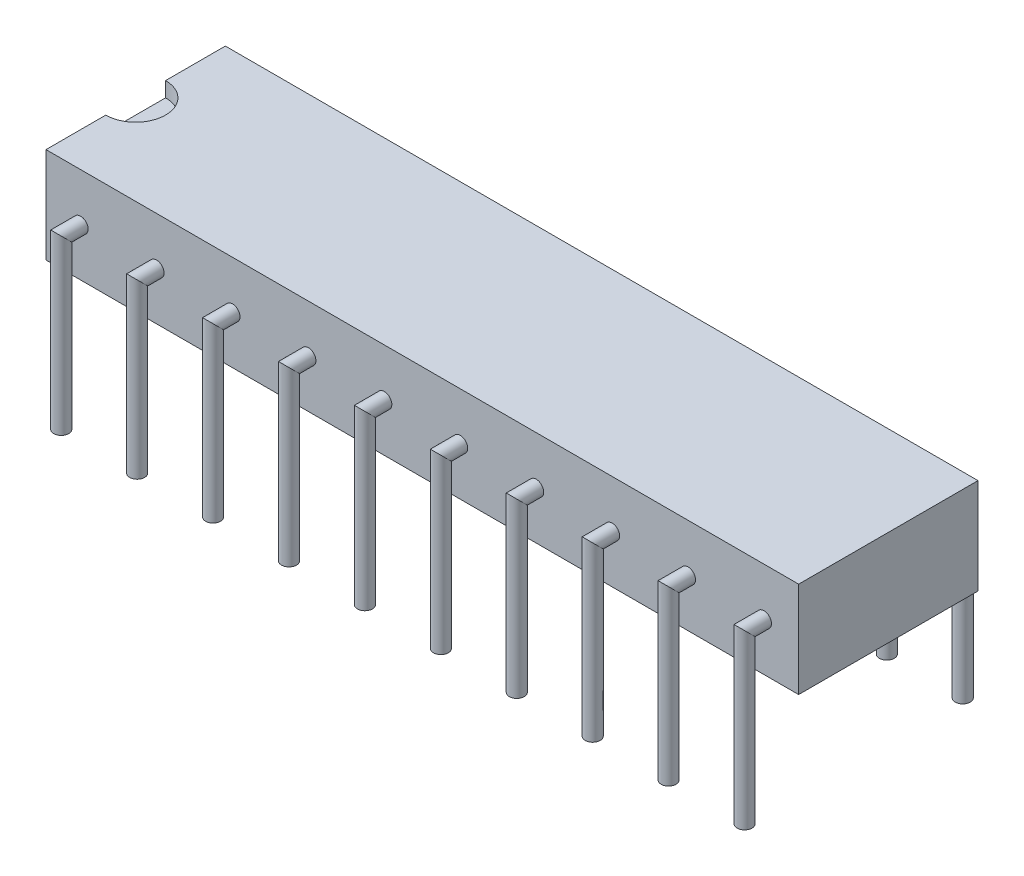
SolidWorks part; units mm, degrees
ref_plane "Plan de face" through (0, 0, 0) normal (0, 0, 1) x (1, 0, 0)
ref_plane "Plan de dessus" through (0, 0, 0) normal (0, 1, 0) x (1, 0, 0)
ref_plane "Plan de droite" through (0, 0, 0) normal (1, 0, 0) x (0, 0, -1)
sketch "Esquisse1" plane through (0, 0, 0) normal (1, 0, 0) x (0, 0, -1)
  line L0 (-34.0084, 0) -> (28.7946, 0) construction
  line L1 (0, -15.76) -> (0, 25.9507) construction
  line L2 (-13.1897, 3.2) -> (13.1184, 3.2) construction
  line L3 (3, 10.112) -> (3, -6.1718) construction
  line L4 (-3, 10.112) -> (-3, -4.99) construction
  line L6 (-3, 3.2) -> (3, 3.2)
  line L7 (-3, 3.2) -> (-3, 0)
  line L8 (-3, 0) -> (3, 0)
  line L9 (3, 3.2) -> (3, 0)
  dimension "D1" = 3
  dimension "D2" = 6
  dimension "D3" = 3.2
extrude "Extrusion1" add sketch "Esquisse1" along normal blind 25.18
sketch "Esquisse2" plane through (0, 3.2, 0) normal (0, 1, 0) x (-1, 0, 0)
  line L0 (0, -1) -> (0, 1)
  arc A0 (0, 1) -> (0, -1) centre (0, 0) ccw
extrude "Enlèv. mat.-Extru.1" cut sketch "Esquisse2" against normal blind 0.5
sketch "Esquisse3" plane through (0, 0, 3) normal (0, 0, 1) x (1, 0, 0)
  line L0 (-0.9705, 0) -> (10.7632, 0) construction
  line L1 (0, 4.319) -> (0, -1.0907) construction
  line L2 (-0.7349, 1.6) -> (2.3847, 1.6) construction
  line L3 (1.16, 2.698) -> (1.16, -1.0907) construction
  circle A0 centre (1.16, 1.6) radius 0.25
  dimension "D1" = 1.6
  dimension "D2" = 1.16
ref_plane "Plan1" through (1.16, 0, 0) normal (1, 0, 0) x (0, 0, -1)
sketch "Esquisse5" plane through (1.16, 0, 0) normal (1, 0, 0) x (0, 0, -1)
  line L0 (-4.2866, 0) -> (4.976, 0) construction
  line L1 (-3, -1.7147) -> (-3, 5.2592) construction
  line L2 (-4.2866, -4) -> (4.976, -4) construction
  line L3 (-3.65, -4.4343) -> (-3.65, 4.8284) construction
  line L4 (-3.7349, 1.6) -> (-3, 1.6) construction
  line L5 (-3, 1.6) -> (-3.65, 1.6)
  line L6 (-3.65, 1.6) -> (-3.65, -4)
  dimension "D1" = 4
  dimension "D2" = 0.65
sweep "Balayage1" add profiles "Esquisse3" path "Esquisse5"
ref_plane "Plan2" through (0, 0, 0) normal (0, 0, 1) x (1, 0, 0)
mirror "Symétrie1" about plane through (0, 0, 0) normal (0, 0, 1) of "Balayage1"
pattern_linear "Répétition linéaire1" count 10 spacing 2.54 along (1, 0, 0) of "Balayage1", "Symétrie1"
